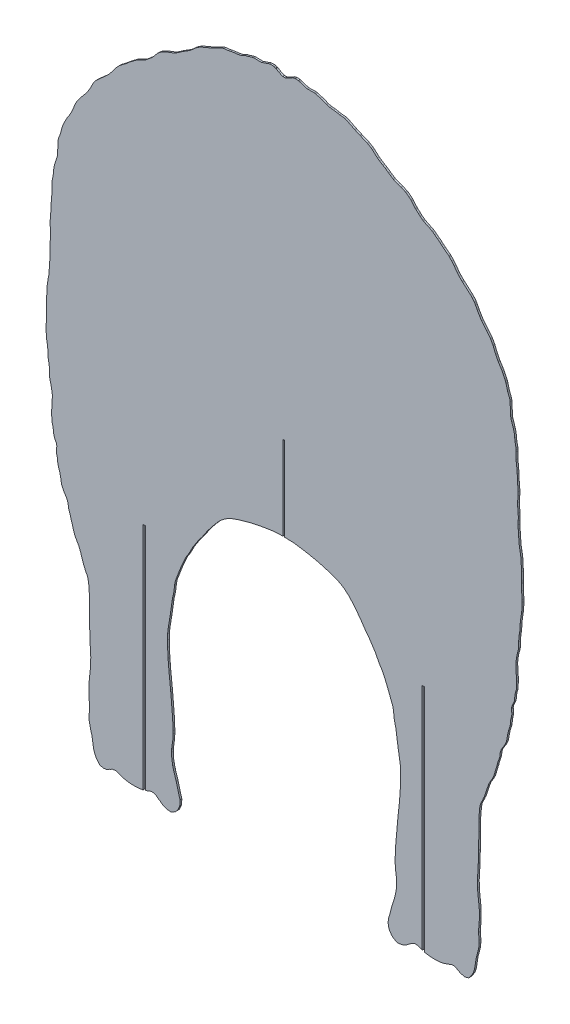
SolidWorks part; units mm, degrees
ref_plane "Спереди" through (0, 0, 0) normal (0, 0, 1) x (1, 0, 0)
ref_plane "Сверху" through (0, 0, 0) normal (0, 1, 0) x (1, 0, 0)
ref_plane "Справа" through (0, 0, 0) normal (1, 0, 0) x (0, 0, -1)
sketch "Model" plane through (0, 0, 0) normal (0, 0, 1) x (1, 0, 0)
  line L0 (-5202.6954, 1099.0275) -> (-5202.6613, 1090.2528)
  line L1 (-5202.6613, 1090.2528) -> (-5202.722, 1088.5068)
  line L2 (-5202.722, 1088.5068) -> (-5202.7725, 1087.6386)
  line L3 (-5202.7725, 1087.6386) -> (-5202.8295, 1086.497)
  line L4 (-5202.8295, 1086.497) -> (-5202.8038, 1080.4098)
  line L5 (-5202.8038, 1080.4098) -> (-5203.304, 1071.0133)
  line L6 (-5203.304, 1071.0133) -> (-5203.3499, 1068.7169)
  line L7 (-5203.3499, 1068.7169) -> (-5203.1594, 1065.0392)
  line L8 (-5203.1594, 1065.0392) -> (-5202.8968, 1060.7317)
  line L9 (-5202.8968, 1060.7317) -> (-5202.8394, 1059.8406)
  line L10 (-5202.8394, 1059.8406) -> (-5202.7721, 1059.4981)
  line L11 (-5202.7721, 1059.4981) -> (-5202.7048, 1059.1557)
  line L12 (-5202.7048, 1059.1557) -> (-5202.5778, 1058.2051)
  line L13 (-5202.5778, 1058.2051) -> (-5201.8625, 1054.0213)
  line L14 (-5201.8625, 1054.0213) -> (-5201.2064, 1048.4236)
  line L15 (-5201.2064, 1048.4236) -> (-5200.9608, 1043.9221)
  line L16 (-5200.9608, 1043.9221) -> (-5200.9158, 1041.1125)
  line L17 (-5200.9158, 1041.1125) -> (-5200.7299, 1040.1642)
  line L18 (-5200.7299, 1040.1642) -> (-5199.9985, 1036.1432)
  line L19 (-5199.9985, 1036.1432) -> (-5199.3775, 1030.2484)
  line L20 (-5199.3775, 1030.2484) -> (-5199.3633, 1030.0172)
  line L21 (-5199.3633, 1030.0172) -> (-5199.349, 1029.7859)
  line L22 (-5199.349, 1029.7859) -> (-5199.3491, 1029.0652)
  line L23 (-5199.3491, 1029.0652) -> (-5199.3344, 1025.183)
  line L24 (-5199.3344, 1025.183) -> (-5199.2947, 1023.4181)
  line L25 (-5199.2947, 1023.4181) -> (-5199.0479, 1021.8089)
  line L26 (-5199.0479, 1021.8089) -> (-5197.7156, 1016.6927)
  line L27 (-5197.7156, 1016.6927) -> (-5197.0541, 1013.0945)
  line L28 (-5197.0541, 1013.0945) -> (-5196.4353, 1008.7228)
  line L29 (-5196.4353, 1008.7228) -> (-5196.4522, 1005.7185)
  line L30 (-5196.4522, 1005.7185) -> (-5196.8237, 996.7969)
  line L31 (-5196.8237, 996.7969) -> (-5197.1856, 993.2269)
  line L32 (-5197.1856, 993.2269) -> (-5197.1784, 990.8832)
  line L33 (-5197.1784, 990.8832) -> (-5196.8452, 982.4718)
  line L34 (-5196.8452, 982.4718) -> (-5196.8103, 982.3772)
  line L35 (-5196.8103, 982.3772) -> (-5196.7753, 982.2826)
  line L36 (-5196.7753, 982.2826) -> (-5196.119, 979.9115)
  line L37 (-5196.119, 979.9115) -> (-5195.7389, 978.5799)
  line L38 (-5195.7389, 978.5799) -> (-5195.3097, 975.8839)
  line L39 (-5195.3097, 975.8839) -> (-5194.6318, 970.3298)
  line L40 (-5194.6318, 970.3298) -> (-5193.9113, 968.4614)
  line L41 (-5193.9113, 968.4614) -> (-5191.9519, 964.4352)
  line L42 (-5191.9519, 964.4352) -> (-5191.7373, 963.2824)
  line L43 (-5191.7373, 963.2824) -> (-5191.3429, 962.0163)
  line L44 (-5191.3429, 962.0163) -> (-5191.7068, 959.2917)
  line L45 (-5191.7068, 959.2917) -> (-5191.9226, 955.297)
  line L46 (-5191.9226, 955.297) -> (-5191.8522, 954.9043)
  line L47 (-5191.8522, 954.9043) -> (-5191.7817, 954.5116)
  line L48 (-5191.7817, 954.5116) -> (-5190.6999, 950.7785)
  line L49 (-5190.6999, 950.7785) -> (-5190.4943, 948.1776)
  line L50 (-5190.4943, 948.1776) -> (-5190.3791, 946.3684)
  line L51 (-5190.3791, 946.3684) -> (-5190.189, 945.3608)
  line L52 (-5190.189, 945.3608) -> (-5190.1329, 944.9966)
  line L53 (-5190.1329, 944.9966) -> (-5190.0769, 944.6323)
  line L54 (-5190.0769, 944.6323) -> (-5189.5729, 942.8308)
  line L55 (-5189.5729, 942.8308) -> (-5188.2397, 938.8125)
  line L56 (-5188.2397, 938.8125) -> (-5187.4042, 935.0848)
  line L57 (-5187.4042, 935.0848) -> (-5186.3434, 928.91)
  line L58 (-5186.3434, 928.91) -> (-5185.9612, 927.2029)
  line L59 (-5185.9612, 927.2029) -> (-5184.4657, 923.8747)
  line L60 (-5184.4657, 923.8747) -> (-5184.075, 922.8846)
  line L61 (-5184.075, 922.8846) -> (-5180.9575, 917.9985)
  line L62 (-5180.9575, 917.9985) -> (-5180.7146, 917.6124)
  line L63 (-5180.7146, 917.6124) -> (-5180.4718, 917.2262)
  line L64 (-5180.4718, 917.2262) -> (-5180.4459, 917.1883)
  line L65 (-5180.4459, 917.1883) -> (-5180.4202, 917.1505)
  line L66 (-5180.4202, 917.1505) -> (-5180.4155, 917.1354)
  line L67 (-5180.4155, 917.1354) -> (-5180.4063, 917.1123)
  line L68 (-5180.4063, 917.1123) -> (-5180.397, 917.0892)
  line L69 (-5180.397, 917.0892) -> (-5178.7982, 912.5182)
  line L70 (-5178.7982, 912.5182) -> (-5178.5048, 908.7762)
  line L71 (-5178.5048, 908.7762) -> (-5177.4256, 905.5194)
  line L72 (-5177.4256, 905.5194) -> (-5176.5963, 903.3575)
  line L73 (-5176.5963, 903.3575) -> (-5175.7757, 900.3268)
  line L74 (-5175.7757, 900.3268) -> (-5175.3259, 898.3794)
  line L75 (-5175.3259, 898.3794) -> (-5174.6636, 896.4902)
  line L76 (-5174.6636, 896.4902) -> (-5173.0345, 890.7728)
  line L77 (-5173.0345, 890.7728) -> (-5171.51, 886.143)
  line L78 (-5171.51, 886.143) -> (-5169.4597, 882.2175)
  line L79 (-5169.4597, 882.2175) -> (-5167.7263, 879.3978)
  line L80 (-5167.7263, 879.3978) -> (-5167.4474, 878.9154)
  line L81 (-5167.4474, 878.9154) -> (-5167.1686, 878.4328)
  line L82 (-5167.1686, 878.4328) -> (-5166.0937, 875.8771)
  line L83 (-5166.0937, 875.8771) -> (-5165.4074, 874.0993)
  line L84 (-5165.4074, 874.0993) -> (-5164.9625, 872.8122)
  line L85 (-5164.9625, 872.8122) -> (-5162.8269, 866.4299)
  line L86 (-5162.8269, 866.4299) -> (-5161.3383, 861.5808)
  line L87 (-5161.3383, 861.5808) -> (-5160.3752, 859.9468)
  line L88 (-5160.3752, 859.9468) -> (-5159.6819, 858.0322)
  line L89 (-5159.6819, 858.0322) -> (-5157.4411, 853.7716)
  line L90 (-5157.4411, 853.7716) -> (-5156.864, 851.5293)
  line L91 (-5156.864, 851.5293) -> (-5156.0519, 847.5389)
  line L92 (-5156.0519, 847.5389) -> (-5155.5784, 840.7879)
  line L93 (-5155.5784, 840.7879) -> (-5155.2749, 837.9112)
  line L94 (-5155.2749, 837.9112) -> (-5155.2221, 837.131)
  line L95 (-5155.2221, 837.131) -> (-5155.3495, 834.1116)
  line L96 (-5155.3495, 834.1116) -> (-5155.3406, 824.707)
  line L97 (-5155.3406, 824.707) -> (-5154.9852, 808.5478)
  line L98 (-5154.9852, 808.5478) -> (-5154.9796, 808.436)
  line L99 (-5154.9796, 808.436) -> (-5154.9777, 808.4044)
  line L100 (-5154.9777, 808.4044) -> (-5154.9758, 808.3728)
  line L101 (-5154.9758, 808.3728) -> (-5154.9719, 808.2165)
  line L102 (-5154.9719, 808.2165) -> (-5154.6212, 793.8742)
  line L103 (-5154.6212, 793.8742) -> (-5153.9423, 781.7596)
  line L104 (-5153.9423, 781.7596) -> (-5153.7074, 777.5233)
  line L105 (-5153.7074, 777.5233) -> (-5153.8593, 770.6618)
  line L106 (-5153.8593, 770.6618) -> (-5153.8638, 769.0992)
  line L107 (-5153.8638, 769.0992) -> (-5154.1451, 766.2424)
  line L108 (-5154.1451, 766.2424) -> (-5155.78, 750.9589)
  line L109 (-5155.78, 750.9589) -> (-5155.8274, 748.5695)
  line L110 (-5155.8274, 748.5695) -> (-5155.813, 742.1856)
  line L111 (-5155.813, 742.1856) -> (-5155.6458, 737.217)
  line L112 (-5155.6458, 737.217) -> (-5155.3478, 733.8855)
  line L113 (-5155.3478, 733.8855) -> (-5155.2457, 732.8574)
  line L114 (-5155.2457, 732.8574) -> (-5155.0552, 731.6394)
  line L115 (-5155.0552, 731.6394) -> (-5155.1755, 727.7783)
  line L116 (-5155.1755, 727.7783) -> (-5155.0831, 726.7011)
  line L117 (-5155.0831, 726.7011) -> (-5155.4994, 721.844)
  line L118 (-5155.4994, 721.844) -> (-5155.4168, 717.852)
  line L119 (-5155.4168, 717.852) -> (-5155.3995, 715.2605)
  line L120 (-5155.3995, 715.2605) -> (-5153.2953, 705.7724)
  line L121 (-5153.2953, 705.7724) -> (-5153.1444, 705.2882)
  line L122 (-5153.1444, 705.2882) -> (-5152.9936, 704.8039)
  line L123 (-5152.9936, 704.8039) -> (-5152.4826, 703.406)
  line L124 (-5152.4826, 703.406) -> (-5150.5491, 690.9375)
  line L125 (-5150.5491, 690.9375) -> (-5149.4514, 687.4006)
  line L126 (-5149.4514, 687.4006) -> (-5147.4421, 683.3005)
  line L127 (-5147.4421, 683.3005) -> (-5147.3192, 683.1079)
  line L128 (-5147.3192, 683.1079) -> (-5147.1438, 682.9483)
  line L129 (-5147.1438, 682.9483) -> (-5146.9684, 682.7888)
  line L130 (-5146.9684, 682.7888) -> (-5144.0571, 679.0772)
  line L131 (-5144.0571, 679.0772) -> (-5143.7053, 678.8127)
  line L132 (-5143.7053, 678.8127) -> (-5143.3536, 678.5483)
  line L133 (-5143.3536, 678.5483) -> (-5142.1622, 678.5129)
  line L134 (-5142.1622, 678.5129) -> (-5140.9709, 678.4774)
  line L135 (-5140.9709, 678.4774) -> (-5140.0018, 678.1411)
  line L136 (-5140.0018, 678.1411) -> (-5139.0327, 677.8049)
  line L137 (-5139.0327, 677.8049) -> (-5137.4784, 678.3115)
  line L138 (-5137.4784, 678.3115) -> (-5136.8331, 678.3803)
  line L139 (-5136.8331, 678.3803) -> (-5136.1879, 678.4493)
  line L140 (-5136.1879, 678.4493) -> (-5133.1083, 680.1442)
  line L141 (-5133.1083, 680.1442) -> (-5131.9337, 680.5439)
  line L142 (-5131.9337, 680.5439) -> (-5130.1296, 681.7739)
  line L143 (-5130.1296, 681.7739) -> (-5127.9844, 682.1023)
  line L144 (-5127.9844, 682.1023) -> (-5127.6564, 682.2944)
  line L145 (-5127.6564, 682.2944) -> (-5127.3284, 682.4867)
  line L146 (-5127.3284, 682.4867) -> (-5126.6455, 682.4519)
  line L147 (-5126.6455, 682.4519) -> (-5125.9627, 682.4172)
  line L148 (-5125.9627, 682.4172) -> (-5125.1232, 682.3525)
  line L149 (-5125.1232, 682.3525) -> (-5122.8449, 681.4699)
  line L150 (-5122.8449, 681.4699) -> (-5116.2452, 679.1328)
  line L151 (-5116.2452, 679.1328) -> (-5113.3743, 678.6247)
  line L152 (-5113.3743, 678.6247) -> (-5109.0183, 678.0993)
  line L153 (-5109.0183, 678.0993) -> (-5104.8963, 678.0749)
  line L154 (-5104.8963, 678.0749) -> (-5101.2264, 678.2614)
  line L155 (-5101.2264, 678.2614) -> (-5096.9241, 678.7651)
  line L156 (-5096.9241, 678.7651) -> (-5095.729, 678.9841)
  line L157 (-5095.729, 678.9841) -> (-5095.7111, 678.9887)
  line L158 (-5095.7111, 678.9887) -> (-5095.7111, 934.2953)
  line L159 (-5095.7111, 934.2953) -> (-5095.4611, 934.2953)
  line L160 (-5095.4611, 934.2953) -> (-5093.4611, 934.2953)
  line L161 (-5093.4611, 934.2953) -> (-5093.2111, 934.2953)
  line L162 (-5093.2111, 934.2953) -> (-5093.2111, 679.5849)
  line L163 (-5093.2111, 679.5849) -> (-5093.1267, 679.6047)
  line L164 (-5093.1267, 679.6047) -> (-5091.9054, 680.1276)
  line L165 (-5091.9054, 680.1276) -> (-5088.0388, 681.7271)
  line L166 (-5088.0388, 681.7271) -> (-5086.8471, 682.013)
  line L167 (-5086.8471, 682.013) -> (-5084.105, 682.1573)
  line L168 (-5084.105, 682.1573) -> (-5083.5109, 682.0266)
  line L169 (-5083.5109, 682.0266) -> (-5082.9168, 681.8957)
  line L170 (-5082.9168, 681.8957) -> (-5080.9629, 680.8281)
  line L171 (-5080.9629, 680.8281) -> (-5078.8604, 678.9016)
  line L172 (-5078.8604, 678.9016) -> (-5078.8162, 678.9692)
  line L173 (-5078.8162, 678.9692) -> (-5078.772, 679.0367)
  line L174 (-5078.772, 679.0367) -> (-5076.4213, 677.5468)
  line L175 (-5076.4213, 677.5468) -> (-5075.4188, 676.5524)
  line L176 (-5075.4188, 676.5524) -> (-5074.6463, 676.0161)
  line L177 (-5074.6463, 676.0161) -> (-5072.4133, 675.0185)
  line L178 (-5072.4133, 675.0185) -> (-5071.9331, 674.7204)
  line L179 (-5071.9331, 674.7204) -> (-5071.4528, 674.4224)
  line L180 (-5071.4528, 674.4224) -> (-5068.3278, 673.654)
  line L181 (-5068.3278, 673.654) -> (-5067.5283, 673.3813)
  line L182 (-5067.5283, 673.3813) -> (-5064.4964, 673.304)
  line L183 (-5064.4964, 673.304) -> (-5063.8679, 673.5256)
  line L184 (-5063.8679, 673.5256) -> (-5063.2395, 673.747)
  line L185 (-5063.2395, 673.747) -> (-5061.3798, 675.1721)
  line L186 (-5061.3798, 675.1721) -> (-5059.8366, 675.8855)
  line L187 (-5059.8366, 675.8855) -> (-5057.3812, 678.5643)
  line L188 (-5057.3812, 678.5643) -> (-5056.7214, 679.6286)
  line L189 (-5056.7214, 679.6286) -> (-5056.5191, 680.4282)
  line L190 (-5056.5191, 680.4282) -> (-5055.6295, 682.297)
  line L191 (-5055.6295, 682.297) -> (-5054.9537, 683.715)
  line L192 (-5054.9537, 683.715) -> (-5054.6406, 689.6416)
  line L193 (-5054.6406, 689.6416) -> (-5054.6367, 689.9714)
  line L194 (-5054.6367, 689.9714) -> (-5054.7415, 690.4467)
  line L195 (-5054.7415, 690.4467) -> (-5056.4092, 696.1143)
  line L196 (-5056.4092, 696.1143) -> (-5058.7814, 705.5661)
  line L197 (-5058.7814, 705.5661) -> (-5058.8091, 705.643)
  line L198 (-5058.8091, 705.643) -> (-5058.8368, 705.7198)
  line L199 (-5058.8368, 705.7198) -> (-5061.3606, 713.4025)
  line L200 (-5061.3606, 713.4025) -> (-5061.9202, 715.7479)
  line L201 (-5061.9202, 715.7479) -> (-5062.7064, 718.5022)
  line L202 (-5062.7064, 718.5022) -> (-5063.084, 721.0147)
  line L203 (-5063.084, 721.0147) -> (-5063.7592, 724.2583)
  line L204 (-5063.7592, 724.2583) -> (-5063.9633, 730.9787)
  line L205 (-5063.9633, 730.9787) -> (-5064.0633, 733.3053)
  line L206 (-5064.0633, 733.3053) -> (-5063.8925, 734.5938)
  line L207 (-5063.8925, 734.5938) -> (-5062.5761, 744.039)
  line L208 (-5062.5761, 744.039) -> (-5062.4101, 749.3352)
  line L209 (-5062.4101, 749.3352) -> (-5062.4069, 752.3161)
  line L210 (-5062.4069, 752.3161) -> (-5062.6228, 759.9057)
  line L211 (-5062.6228, 759.9057) -> (-5063.0546, 766.9058)
  line L212 (-5063.0546, 766.9058) -> (-5064.7495, 786.9555)
  line L213 (-5064.7495, 786.9555) -> (-5064.8992, 788.524)
  line L214 (-5064.8992, 788.524) -> (-5065.0633, 790.3146)
  line L215 (-5065.0633, 790.3146) -> (-5066.9088, 807.7543)
  line L216 (-5066.9088, 807.7543) -> (-5067.4115, 813.884)
  line L217 (-5067.4115, 813.884) -> (-5067.8513, 818.4278)
  line L218 (-5067.8513, 818.4278) -> (-5067.9194, 819.8093)
  line L219 (-5067.9194, 819.8093) -> (-5068.387, 829.4878)
  line L220 (-5068.387, 829.4878) -> (-5068.3911, 836.7295)
  line L221 (-5068.3911, 836.7295) -> (-5068.4461, 842.4897)
  line L222 (-5068.4461, 842.4897) -> (-5067.7922, 848.131)
  line L223 (-5067.7922, 848.131) -> (-5067.7898, 848.1542)
  line L224 (-5067.7898, 848.1542) -> (-5067.7874, 848.1775)
  line L225 (-5067.7874, 848.1775) -> (-5067.7687, 848.2898)
  line L226 (-5067.7687, 848.2898) -> (-5065.7103, 860.8678)
  line L227 (-5065.7103, 860.8678) -> (-5064.3615, 869.9947)
  line L228 (-5064.3615, 869.9947) -> (-5063.4254, 876.9441)
  line L229 (-5063.4254, 876.9441) -> (-5063.0011, 879.5567)
  line L230 (-5063.0011, 879.5567) -> (-5062.3021, 882.4)
  line L231 (-5062.3021, 882.4) -> (-5061.4442, 886.4664)
  line L232 (-5061.4442, 886.4664) -> (-5060.6844, 893.0699)
  line L233 (-5060.6844, 893.0699) -> (-5060.5956, 893.9961)
  line L234 (-5060.5956, 893.9961) -> (-5060.5634, 894.1227)
  line L235 (-5060.5634, 894.1227) -> (-5060.5313, 894.2491)
  line L236 (-5060.5313, 894.2491) -> (-5059.7145, 898.1553)
  line L237 (-5059.7145, 898.1553) -> (-5059.0864, 899.9397)
  line L238 (-5059.0864, 899.9397) -> (-5058.962, 900.2528)
  line L239 (-5058.962, 900.2528) -> (-5058.8376, 900.5658)
  line L240 (-5058.8376, 900.5658) -> (-5058.2587, 901.969)
  line L241 (-5058.2587, 901.969) -> (-5054.9058, 910.9272)
  line L242 (-5054.9058, 910.9272) -> (-5051.497, 919.1446)
  line L243 (-5051.497, 919.1446) -> (-5050.2281, 921.8449)
  line L244 (-5050.2281, 921.8449) -> (-5048.167, 926.3814)
  line L245 (-5048.167, 926.3814) -> (-5045.7388, 930.0707)
  line L246 (-5045.7388, 930.0707) -> (-5045.1654, 931.0162)
  line L247 (-5045.1654, 931.0162) -> (-5043.5745, 933.9931)
  line L248 (-5043.5745, 933.9931) -> (-5040.2687, 940.3531)
  line L249 (-5040.2687, 940.3531) -> (-5035.7192, 947.2965)
  line L250 (-5035.7192, 947.2965) -> (-5033.5709, 950.5819)
  line L251 (-5033.5709, 950.5819) -> (-5031.7586, 952.8146)
  line L252 (-5031.7586, 952.8146) -> (-5030.5583, 954.3714)
  line L253 (-5030.5583, 954.3714) -> (-5027.3518, 958.8523)
  line L254 (-5027.3518, 958.8523) -> (-5027.21, 959.0665)
  line L255 (-5027.21, 959.0665) -> (-5027.0682, 959.2809)
  line L256 (-5027.0682, 959.2809) -> (-5026.9401, 959.4217)
  line L257 (-5026.9401, 959.4217) -> (-5025.1249, 962.3045)
  line L258 (-5025.1249, 962.3045) -> (-5023.9854, 964.0729)
  line L259 (-5023.9854, 964.0729) -> (-5021.7281, 966.8559)
  line L260 (-5021.7281, 966.8559) -> (-5020.1921, 969.0414)
  line L261 (-5020.1921, 969.0414) -> (-5016.4483, 973.5843)
  line L262 (-5016.4483, 973.5843) -> (-5015.2499, 975.0765)
  line L263 (-5015.2499, 975.0765) -> (-5013.1365, 977.3758)
  line L264 (-5013.1365, 977.3758) -> (-5011.3665, 979.3941)
  line L265 (-5011.3665, 979.3941) -> (-5010.9033, 979.9366)
  line L266 (-5010.9033, 979.9366) -> (-5009.9137, 980.8534)
  line L267 (-5009.9137, 980.8534) -> (-5005.4434, 984.4811)
  line L268 (-5005.4434, 984.4811) -> (-5004.6682, 984.9928)
  line L269 (-5004.6682, 984.9928) -> (-5001.7788, 986.8583)
  line L270 (-5001.7788, 986.8583) -> (-4998.0692, 988.6616)
  line L271 (-4998.0692, 988.6616) -> (-4997.4453, 988.9515)
  line L272 (-4997.4453, 988.9515) -> (-4996.8214, 989.2413)
  line L273 (-4996.8214, 989.2413) -> (-4989.069, 991.9322)
  line L274 (-4989.069, 991.9322) -> (-4988.091, 992.2569)
  line L275 (-4988.091, 992.2569) -> (-4987.256, 992.4718)
  line L276 (-4987.256, 992.4718) -> (-4986.421, 992.6867)
  line L277 (-4986.421, 992.6867) -> (-4977.1057, 995.316)
  line L278 (-4977.1057, 995.316) -> (-4969.195, 997.0088)
  line L279 (-4969.195, 997.0088) -> (-4968.6661, 997.1231)
  line L280 (-4968.6661, 997.1231) -> (-4968.1375, 997.2374)
  line L281 (-4968.1375, 997.2374) -> (-4963.2979, 998.155)
  line L282 (-4963.2979, 998.155) -> (-4961.0531, 998.5993)
  line L283 (-4961.0531, 998.5993) -> (-4960.8129, 998.6296)
  line L284 (-4960.8129, 998.6296) -> (-4951.7425, 999.9855)
  line L285 (-4951.7425, 999.9855) -> (-4949.61, 1000.1376)
  line L286 (-4949.61, 1000.1376) -> (-4944.8473, 1000.5338)
  line L287 (-4944.8473, 1000.5338) -> (-4940.4611, 1000.5564)
  line L288 (-4940.4611, 1000.5564) -> (-4940.4611, 1093.6418)
  line L289 (-4940.4611, 1093.6418) -> (-4938.4611, 1093.6418)
  line L290 (-4938.4611, 1093.6418) -> (-4938.4611, 1000.5414)
  line L295 (-4938.4611, 1000.5414) -> (-4929.0118, 1000.2191)
  line L296 (-4929.0118, 1000.2191) -> (-4928.0068, 1000.1334)
  line L297 (-4928.0068, 1000.1334) -> (-4927.0017, 1000.0476)
  line L298 (-4927.0017, 1000.0476) -> (-4917.3661, 998.6314)
  line L299 (-4917.3661, 998.6314) -> (-4917.0518, 998.5912)
  line L300 (-4917.0518, 998.5912) -> (-4914.8036, 998.1426)
  line L301 (-4914.8036, 998.1426) -> (-4909.9403, 997.2215)
  line L302 (-4909.9403, 997.2215) -> (-4908.5605, 996.9237)
  line L303 (-4908.5605, 996.9237) -> (-4901.0555, 995.3148)
  line L304 (-4901.0555, 995.3148) -> (-4891.7802, 992.7018)
  line L305 (-4891.7802, 992.7018) -> (-4890.1712, 992.2857)
  line L306 (-4890.1712, 992.2857) -> (-4889.2486, 991.975)
  line L307 (-4889.2486, 991.975) -> (-4881.4832, 989.32)
  line L308 (-4881.4832, 989.32) -> (-4877.3622, 987.2958)
  line L309 (-4877.3622, 987.2958) -> (-4876.3005, 986.8226)
  line L310 (-4876.3005, 986.8226) -> (-4872.6542, 984.4324)
  line L311 (-4872.6542, 984.4324) -> (-4872.451, 984.296)
  line L312 (-4872.451, 984.296) -> (-4872.2477, 984.1598)
  line L313 (-4872.2477, 984.1598) -> (-4872.0983, 984.0218)
  line L314 (-4872.0983, 984.0218) -> (-4871.949, 983.884)
  line L315 (-4871.949, 983.884) -> (-4867.0999, 979.802)
  line L316 (-4867.0999, 979.802) -> (-4866.8335, 979.4981)
  line L317 (-4866.8335, 979.4981) -> (-4866.5671, 979.1944)
  line L318 (-4866.5671, 979.1944) -> (-4864.8482, 977.19)
  line L319 (-4864.8482, 977.19) -> (-4862.8944, 975.0598)
  line L320 (-4862.8944, 975.0598) -> (-4861.4952, 973.3164)
  line L321 (-4861.4952, 973.3164) -> (-4857.9316, 968.9934)
  line L322 (-4857.9316, 968.9934) -> (-4856.4099, 966.8185)
  line L323 (-4856.4099, 966.8185) -> (-4854.1273, 964.0057)
  line L324 (-4854.1273, 964.0057) -> (-4852.916, 962.11)
  line L325 (-4852.916, 962.11) -> (-4851.2769, 959.4903)
  line L326 (-4851.2769, 959.4903) -> (-4851.1787, 959.3839)
  line L327 (-4851.1787, 959.3839) -> (-4850.9587, 959.0514)
  line L328 (-4850.9587, 959.0514) -> (-4847.6622, 954.458)
  line L329 (-4847.6622, 954.458) -> (-4846.3833, 952.7939)
  line L330 (-4846.3833, 952.7939) -> (-4844.5884, 950.5804)
  line L331 (-4844.5884, 950.5804) -> (-4842.3912, 947.2152)
  line L332 (-4842.3912, 947.2152) -> (-4837.9391, 940.4322)
  line L333 (-4837.9391, 940.4322) -> (-4834.6139, 934.0521)
  line L334 (-4834.6139, 934.0521) -> (-4832.9069, 930.8635)
  line L335 (-4832.9069, 930.8635) -> (-4832.2498, 929.7693)
  line L336 (-4832.2498, 929.7693) -> (-4829.9681, 926.3189)
  line L337 (-4829.9681, 926.3189) -> (-4827.921, 921.8161)
  line L338 (-4827.921, 921.8161) -> (-4826.7684, 919.3771)
  line L339 (-4826.7684, 919.3771) -> (-4823.3662, 911.2057)
  line L340 (-4823.3662, 911.2057) -> (-4819.7588, 901.6056)
  line L341 (-4819.7588, 901.6056) -> (-4819.2579, 900.3867)
  line L342 (-4819.2579, 900.3867) -> (-4819.1575, 900.1383)
  line L343 (-4819.1575, 900.1383) -> (-4819.0572, 899.89)
  line L344 (-4819.0572, 899.89) -> (-4818.413, 898.0543)
  line L345 (-4818.413, 898.0543) -> (-4817.6482, 894.3298)
  line L346 (-4817.6482, 894.3298) -> (-4817.5605, 893.9819)
  line L347 (-4817.5605, 893.9819) -> (-4817.4094, 892.3543)
  line L348 (-4817.4094, 892.3543) -> (-4816.9723, 888.3692)
  line L349 (-4816.9723, 888.3692) -> (-4816.7769, 886.7096)
  line L350 (-4816.7769, 886.7096) -> (-4815.9309, 882.6775)
  line L351 (-4815.9309, 882.6775) -> (-4815.1305, 879.332)
  line L352 (-4815.1305, 879.332) -> (-4814.7364, 876.9293)
  line L353 (-4814.7364, 876.9293) -> (-4813.8366, 870.2795)
  line L354 (-4813.8366, 870.2795) -> (-4812.1928, 859.1339)
  line L355 (-4812.1928, 859.1339) -> (-4810.482, 848.7718)
  line L356 (-4810.482, 848.7718) -> (-4810.3412, 847.935)
  line L357 (-4810.3412, 847.935) -> (-4810.302, 847.5554)
  line L358 (-4810.302, 847.5554) -> (-4809.727, 842.6872)
  line L359 (-4809.727, 842.6872) -> (-4809.7962, 836.8834)
  line L360 (-4809.7962, 836.8834) -> (-4809.786, 828.9548)
  line L361 (-4809.786, 828.9548) -> (-4810.1534, 821.3894)
  line L362 (-4810.1534, 821.3894) -> (-4810.2472, 819.2882)
  line L363 (-4810.2472, 819.2882) -> (-4810.8243, 812.8227)
  line L364 (-4810.8243, 812.8227) -> (-4811.0833, 809.1893)
  line L365 (-4811.0833, 809.1893) -> (-4812.2191, 798.5748)
  line L366 (-4812.2191, 798.5748) -> (-4813.008, 791.162)
  line L367 (-4813.008, 791.162) -> (-4815.0799, 767.2858)
  line L368 (-4815.0799, 767.2858) -> (-4815.5393, 759.8237)
  line L369 (-4815.5393, 759.8237) -> (-4815.7617, 752.4594)
  line L370 (-4815.7617, 752.4594) -> (-4815.7554, 749.7688)
  line L371 (-4815.7554, 749.7688) -> (-4815.5853, 744.1539)
  line L372 (-4815.5853, 744.1539) -> (-4814.1558, 733.6004)
  line L373 (-4814.1558, 733.6004) -> (-4814.1313, 733.4191)
  line L374 (-4814.1313, 733.4191) -> (-4814.1441, 733.0771)
  line L375 (-4814.1441, 733.0771) -> (-4814.3704, 724.6057)
  line L376 (-4814.3704, 724.6057) -> (-4815.0423, 721.2351)
  line L377 (-4815.0423, 721.2351) -> (-4815.2257, 719.6508)
  line L378 (-4815.2257, 719.6508) -> (-4816.0154, 717.03)
  line L379 (-4816.0154, 717.03) -> (-4816.2175, 715.6777)
  line L380 (-4816.2175, 715.6777) -> (-4816.7387, 713.6272)
  line L381 (-4816.7387, 713.6272) -> (-4818.9255, 706.9362)
  line L382 (-4818.9255, 706.9362) -> (-4819.6244, 704.9809)
  line L383 (-4819.6244, 704.9809) -> (-4821.9199, 695.6003)
  line L384 (-4821.9199, 695.6003) -> (-4822.955, 692.3139)
  line L385 (-4822.955, 692.3139) -> (-4823.3551, 690.285)
  line L386 (-4823.3551, 690.285) -> (-4823.5292, 688.1691)
  line L387 (-4823.5292, 688.1691) -> (-4823.5377, 686.6945)
  line L388 (-4823.5377, 686.6945) -> (-4823.1473, 683.6755)
  line L389 (-4823.1473, 683.6755) -> (-4822.7586, 682.5433)
  line L390 (-4822.7586, 682.5433) -> (-4822.5069, 681.4824)
  line L391 (-4822.5069, 681.4824) -> (-4820.8359, 678.9912)
  line L392 (-4820.8359, 678.9912) -> (-4820.226, 677.9311)
  line L393 (-4820.226, 677.9311) -> (-4818.1917, 675.7983)
  line L394 (-4818.1917, 675.7983) -> (-4816.6343, 675.0896)
  line L395 (-4816.6343, 675.0896) -> (-4815.0059, 673.7424)
  line L396 (-4815.0059, 673.7424) -> (-4813.781, 673.3898)
  line L397 (-4813.781, 673.3898) -> (-4811.2436, 673.344)
  line L398 (-4811.2436, 673.344) -> (-4810.2442, 673.6357)
  line L399 (-4810.2442, 673.6357) -> (-4806.8604, 674.2902)
  line L400 (-4806.8604, 674.2902) -> (-4805.0705, 675.3774)
  line L401 (-4805.0705, 675.3774) -> (-4802.5789, 676.6401)
  line L402 (-4802.5789, 676.6401) -> (-4802.143, 677.0119)
  line L403 (-4802.143, 677.0119) -> (-4801.8483, 677.3271)
  line L404 (-4801.8483, 677.3271) -> (-4799.2142, 679.2065)
  line L405 (-4799.2142, 679.2065) -> (-4798.1901, 680.0669)
  line L406 (-4798.1901, 680.0669) -> (-4797.6116, 680.4707)
  line L407 (-4797.6116, 680.4707) -> (-4797.0331, 680.8743)
  line L408 (-4797.0331, 680.8743) -> (-4794.7575, 681.965)
  line L409 (-4794.7575, 681.965) -> (-4794.2679, 682.0551)
  line L410 (-4794.2679, 682.0551) -> (-4793.7783, 682.1453)
  line L411 (-4793.7783, 682.1453) -> (-4790.887, 681.9056)
  line L412 (-4790.887, 681.9056) -> (-4790.4952, 681.8159)
  line L413 (-4790.4952, 681.8159) -> (-4790.1034, 681.7263)
  line L414 (-4790.1034, 681.7263) -> (-4786.1959, 680.0918)
  line L415 (-4786.1959, 680.0918) -> (-4785.8285, 679.9748)
  line L416 (-4785.8285, 679.9748) -> (-4785.7111, 679.9375)
  line L417 (-4785.7111, 679.9375) -> (-4785.7111, 934.2953)
  line L418 (-4785.7111, 934.2953) -> (-4785.4611, 934.2953)
  line L419 (-4785.4611, 934.2953) -> (-4783.4611, 934.2953)
  line L420 (-4783.4611, 934.2953) -> (-4783.2111, 934.2953)
  line L421 (-4783.2111, 934.2953) -> (-4783.2111, 679.1421)
  line L422 (-4783.2111, 679.1421) -> (-4783.1671, 679.1281)
  line L423 (-4783.1671, 679.1281) -> (-4782.8548, 679.0683)
  line L424 (-4782.8548, 679.0683) -> (-4782.7376, 679.069)
  line L425 (-4782.7376, 679.069) -> (-4782.6203, 679.0697)
  line L426 (-4782.6203, 679.0697) -> (-4777.6592, 678.3399)
  line L427 (-4777.6592, 678.3399) -> (-4773.5696, 678.0676)
  line L428 (-4773.5696, 678.0676) -> (-4769.3945, 678.1076)
  line L429 (-4769.3945, 678.1076) -> (-4764.9843, 678.5476)
  line L430 (-4764.9843, 678.5476) -> (-4762.2557, 679.0578)
  line L431 (-4762.2557, 679.0578) -> (-4758.9929, 680.1176)
  line L432 (-4758.9929, 680.1176) -> (-4756.1631, 681.1357)
  line L433 (-4756.1631, 681.1357) -> (-4752.9693, 682.3903)
  line L434 (-4752.9693, 682.3903) -> (-4751.9332, 682.528)
  line L435 (-4751.9332, 682.528) -> (-4750.6917, 682.5009)
  line L436 (-4750.6917, 682.5009) -> (-4750.0297, 682.1201)
  line L437 (-4750.0297, 682.1201) -> (-4748.6306, 681.8828)
  line L438 (-4748.6306, 681.8828) -> (-4746.684, 680.7819)
  line L439 (-4746.684, 680.7819) -> (-4745.9604, 680.5158)
  line L440 (-4745.9604, 680.5158) -> (-4742.7314, 678.724)
  line L441 (-4742.7314, 678.724) -> (-4740.3545, 678.3547)
  line L442 (-4740.3545, 678.3547) -> (-4738.7493, 677.7153)
  line L443 (-4738.7493, 677.7153) -> (-4735.3283, 678.7171)
  line L444 (-4735.3283, 678.7171) -> (-4734.8573, 678.7563)
  line L445 (-4734.8573, 678.7563) -> (-4734.3864, 678.7954)
  line L446 (-4734.3864, 678.7954) -> (-4733.9733, 679.1235)
  line L447 (-4733.9733, 679.1235) -> (-4730.7924, 683.1917)
  line L448 (-4730.7924, 683.1917) -> (-4730.6945, 683.5412)
  line L449 (-4730.6945, 683.5412) -> (-4728.9125, 686.5385)
  line L450 (-4728.9125, 686.5385) -> (-4727.7004, 690.5074)
  line L451 (-4727.7004, 690.5074) -> (-4725.5785, 703.594)
  line L452 (-4725.5785, 703.594) -> (-4725.4233, 704.0153)
  line L453 (-4725.4233, 704.0153) -> (-4725.2681, 704.4366)
  line L454 (-4725.2681, 704.4366) -> (-4723.9169, 709.7834)
  line L455 (-4723.9169, 709.7834) -> (-4723.0822, 713.049)
  line L456 (-4723.0822, 713.049) -> (-4723.037, 713.4035)
  line L457 (-4723.037, 713.4035) -> (-4722.966, 714.0703)
  line L458 (-4722.966, 714.0703) -> (-4722.7033, 717.6585)
  line L459 (-4722.7033, 717.6585) -> (-4722.6384, 720.8841)
  line L460 (-4722.6384, 720.8841) -> (-4723.1289, 727.3759)
  line L461 (-4723.1289, 727.3759) -> (-4722.9994, 728.7846)
  line L462 (-4722.9994, 728.7846) -> (-4723.0092, 732.465)
  line L463 (-4723.0092, 732.465) -> (-4722.9203, 733.1074)
  line L464 (-4722.9203, 733.1074) -> (-4722.7566, 734.6644)
  line L465 (-4722.7566, 734.6644) -> (-4722.4749, 738.0383)
  line L466 (-4722.4749, 738.0383) -> (-4722.3359, 742.0349)
  line L467 (-4722.3359, 742.0349) -> (-4722.3278, 748.3286)
  line L468 (-4722.3278, 748.3286) -> (-4722.3821, 750.785)
  line L469 (-4722.3821, 750.785) -> (-4722.8673, 755.7751)
  line L470 (-4722.8673, 755.7751) -> (-4724.2868, 768.7885)
  line L471 (-4724.2868, 768.7885) -> (-4724.2963, 770.6419)
  line L472 (-4724.2963, 770.6419) -> (-4724.4696, 777.1401)
  line L473 (-4724.4696, 777.1401) -> (-4724.2258, 781.5145)
  line L474 (-4724.2258, 781.5145) -> (-4723.5514, 793.6723)
  line L475 (-4723.5514, 793.6723) -> (-4723.5198, 794.7882)
  line L476 (-4723.5198, 794.7882) -> (-4723.2529, 806.5016)
  line L477 (-4723.2529, 806.5016) -> (-4723.2492, 806.5965)
  line L478 (-4723.2492, 806.5965) -> (-4723.2456, 806.6915)
  line L479 (-4723.2456, 806.6915) -> (-4723.24, 806.7481)
  line L480 (-4723.24, 806.7481) -> (-4723.2344, 806.8049)
  line L481 (-4723.2344, 806.8049) -> (-4723.2093, 807.3633)
  line L482 (-4723.2093, 807.3633) -> (-4722.811, 825.0754)
  line L483 (-4722.811, 825.0754) -> (-4722.8187, 833.9035)
  line L484 (-4722.8187, 833.9035) -> (-4722.9403, 836.8752)
  line L485 (-4722.9403, 836.8752) -> (-4722.8723, 837.6803)
  line L486 (-4722.8723, 837.6803) -> (-4722.2763, 844.5877)
  line L487 (-4722.2763, 844.5877) -> (-4721.9786, 848.748)
  line L488 (-4721.9786, 848.748) -> (-4721.8596, 849.2395)
  line L489 (-4721.8596, 849.2395) -> (-4721.1259, 852.4067)
  line L490 (-4721.1259, 852.4067) -> (-4719.9884, 855.2287)
  line L491 (-4719.9884, 855.2287) -> (-4718.4292, 858.0101)
  line L492 (-4718.4292, 858.0101) -> (-4717.7593, 860.0223)
  line L493 (-4717.7593, 860.0223) -> (-4716.6936, 861.9866)
  line L494 (-4716.6936, 861.9866) -> (-4715.2581, 866.7219)
  line L495 (-4715.2581, 866.7219) -> (-4713.1996, 872.7103)
  line L496 (-4713.1996, 872.7103) -> (-4712.5807, 874.4686)
  line L497 (-4712.5807, 874.4686) -> (-4711.3427, 877.7738)
  line L498 (-4711.3427, 877.7738) -> (-4711.3049, 877.8651)
  line L499 (-4711.3049, 877.8651) -> (-4711.267, 877.9563)
  line L500 (-4711.267, 877.9563) -> (-4711.2214, 878.0345)
  line L501 (-4711.2214, 878.0345) -> (-4711.1759, 878.1127)
  line L502 (-4711.1759, 878.1127) -> (-4708.1428, 883.1634)
  line L503 (-4708.1428, 883.1634) -> (-4706.6845, 885.983)
  line L504 (-4706.6845, 885.983) -> (-4705.2879, 890.3176)
  line L505 (-4705.2879, 890.3176) -> (-4703.2799, 897.1166)
  line L506 (-4703.2799, 897.1166) -> (-4702.7252, 898.7571)
  line L507 (-4702.7252, 898.7571) -> (-4702.2051, 900.9188)
  line L508 (-4702.2051, 900.9188) -> (-4701.5542, 903.3888)
  line L509 (-4701.5542, 903.3888) -> (-4700.7691, 905.4183)
  line L510 (-4700.7691, 905.4183) -> (-4699.6224, 908.9383)
  line L511 (-4699.6224, 908.9383) -> (-4699.3101, 912.7568)
  line L512 (-4699.3101, 912.7568) -> (-4698.2972, 915.9619)
  line L513 (-4698.2972, 915.9619) -> (-4698.1599, 916.3014)
  line L514 (-4698.1599, 916.3014) -> (-4698.0226, 916.6407)
  line L515 (-4698.0226, 916.6407) -> (-4697.4577, 917.5128)
  line L516 (-4697.4577, 917.5128) -> (-4696.1778, 919.6491)
  line L517 (-4696.1778, 919.6491) -> (-4694.218, 922.6712)
  line L518 (-4694.218, 922.6712) -> (-4692.277, 927.0606)
  line L519 (-4692.277, 927.0606) -> (-4691.8341, 928.9808)
  line L520 (-4691.8341, 928.9808) -> (-4690.7719, 935.0184)
  line L521 (-4690.7719, 935.0184) -> (-4689.9043, 938.8235)
  line L522 (-4689.9043, 938.8235) -> (-4688.3107, 943.7525)
  line L523 (-4688.3107, 943.7525) -> (-4688.0664, 944.6705)
  line L524 (-4688.0664, 944.6705) -> (-4688.0203, 944.923)
  line L525 (-4688.0203, 944.923) -> (-4687.9211, 945.447)
  line L526 (-4687.9211, 945.447) -> (-4687.8659, 946.294)
  line L527 (-4687.8659, 946.294) -> (-4687.4362, 950.8751)
  line L528 (-4687.4362, 950.8751) -> (-4687.0392, 952.0624)
  line L529 (-4687.0392, 952.0624) -> (-4686.3438, 955.7312)
  line L530 (-4686.3438, 955.7312) -> (-4686.2863, 957.812)
  line L531 (-4686.2863, 957.812) -> (-4686.7116, 961.716)
  line L532 (-4686.7116, 961.716) -> (-4686.4224, 962.8934)
  line L533 (-4686.4224, 962.8934) -> (-4686.1708, 964.5421)
  line L534 (-4686.1708, 964.5421) -> (-4684.1772, 968.5993)
  line L535 (-4684.1772, 968.5993) -> (-4683.5048, 970.3371)
  line L536 (-4683.5048, 970.3371) -> (-4682.8531, 976.1028)
  line L537 (-4682.8531, 976.1028) -> (-4682.5304, 978.2178)
  line L538 (-4682.5304, 978.2178) -> (-4682.072, 979.8141)
  line L539 (-4682.072, 979.8141) -> (-4681.3311, 982.2506)
  line L540 (-4681.3311, 982.2506) -> (-4681.0439, 989.6561)
  line L541 (-4681.0439, 989.6561) -> (-4680.9132, 990.9825)
  line L542 (-4680.9132, 990.9825) -> (-4680.9627, 993.415)
  line L543 (-4680.9627, 993.415) -> (-4681.3265, 996.5099)
  line L544 (-4681.3265, 996.5099) -> (-4681.7286, 1005.6533)
  line L545 (-4681.7286, 1005.6533) -> (-4681.7591, 1007.9551)
  line L546 (-4681.7591, 1007.9551) -> (-4681.1013, 1013.1407)
  line L547 (-4681.1013, 1013.1407) -> (-4680.4231, 1016.843)
  line L548 (-4680.4231, 1016.843) -> (-4679.0476, 1021.8546)
  line L549 (-4679.0476, 1021.8546) -> (-4678.8826, 1022.9438)
  line L550 (-4678.8826, 1022.9438) -> (-4678.8699, 1024.0168)
  line L551 (-4678.8699, 1024.0168) -> (-4678.7792, 1029.5137)
  line L552 (-4678.7792, 1029.5137) -> (-4678.7774, 1029.6841)
  line L553 (-4678.7774, 1029.6841) -> (-4678.7735, 1029.7434)
  line L554 (-4678.7735, 1029.7434) -> (-4678.1662, 1036.1206)
  line L555 (-4678.1662, 1036.1206) -> (-4677.5728, 1039.68)
  line L556 (-4677.5728, 1039.68) -> (-4677.2586, 1041.3083)
  line L557 (-4677.2586, 1041.3083) -> (-4677.2489, 1043.3573)
  line L558 (-4677.2489, 1043.3573) -> (-4676.964, 1048.2626)
  line L559 (-4676.964, 1048.2626) -> (-4676.2813, 1054.2578)
  line L560 (-4676.2813, 1054.2578) -> (-4675.5877, 1058.2654)
  line L561 (-4675.5877, 1058.2654) -> (-4675.4504, 1059.3078)
  line L562 (-4675.4504, 1059.3078) -> (-4675.3467, 1059.8104)
  line L563 (-4675.3467, 1059.8104) -> (-4675.2841, 1060.6291)
  line L564 (-4675.2841, 1060.6291) -> (-4675.0459, 1064.7119)
  line L565 (-4675.0459, 1064.7119) -> (-4674.8051, 1069.5183)
  line L566 (-4674.8051, 1069.5183) -> (-4674.8637, 1072.2677)
  line L567 (-4674.8637, 1072.2677) -> (-4675.369, 1080.0578)
  line L568 (-4675.369, 1080.0578) -> (-4675.3502, 1087.0722)
  line L569 (-4675.3502, 1087.0722) -> (-4675.3996, 1088.0815)
  line L570 (-4675.3996, 1088.0815) -> (-4675.4356, 1088.5976)
  line L571 (-4675.4356, 1088.5976) -> (-4675.4854, 1090.0038)
  line L572 (-4675.4854, 1090.0038) -> (-4675.4524, 1098.8334)
  line L573 (-4675.4524, 1098.8334) -> (-4675.5952, 1101.6706)
  line L574 (-4675.5952, 1101.6706) -> (-4676.1317, 1111.3095)
  line L575 (-4676.1317, 1111.3095) -> (-4676.1747, 1111.8085)
  line L576 (-4676.1747, 1111.8085) -> (-4676.2519, 1112.2665)
  line L577 (-4676.2519, 1112.2665) -> (-4677.0981, 1117.7736)
  line L578 (-4677.0981, 1117.7736) -> (-4677.8741, 1121.7863)
  line L579 (-4677.8741, 1121.7863) -> (-4678.4254, 1128.3175)
  line L580 (-4678.4254, 1128.3175) -> (-4678.6588, 1130.3949)
  line L581 (-4678.6588, 1130.3949) -> (-4678.786, 1134.0282)
  line L582 (-4678.786, 1134.0282) -> (-4679.1392, 1137.9076)
  line L583 (-4679.1392, 1137.9076) -> (-4679.2705, 1141.8537)
  line L584 (-4679.2705, 1141.8537) -> (-4679.1524, 1145.8654)
  line L585 (-4679.1524, 1145.8654) -> (-4679.0785, 1149.9325)
  line L586 (-4679.0785, 1149.9325) -> (-4679.2369, 1153.2965)
  line L587 (-4679.2369, 1153.2965) -> (-4679.7006, 1158.8661)
  line L588 (-4679.7006, 1158.8661) -> (-4679.8449, 1162.9772)
  line L589 (-4679.8449, 1162.9772) -> (-4679.4274, 1169.696)
  line L590 (-4679.4274, 1169.696) -> (-4679.3568, 1173.8752)
  line L591 (-4679.3568, 1173.8752) -> (-4679.6567, 1179.2629)
  line L592 (-4679.6567, 1179.2629) -> (-4680.0359, 1182.8544)
  line L593 (-4680.0359, 1182.8544) -> (-4680.0709, 1185.9181)
  line L594 (-4680.0709, 1185.9181) -> (-4680.2575, 1190.5478)
  line L595 (-4680.2575, 1190.5478) -> (-4680.5968, 1193.7292)
  line L596 (-4680.5968, 1193.7292) -> (-4680.6509, 1195.829)
  line L597 (-4680.6509, 1195.829) -> (-4681.3209, 1201.0588)
  line L598 (-4681.3209, 1201.0588) -> (-4681.6332, 1203.258)
  line L599 (-4681.6332, 1203.258) -> (-4681.5874, 1210.9411)
  line L600 (-4681.5874, 1210.9411) -> (-4681.3896, 1213.1027)
  line L601 (-4681.3896, 1213.1027) -> (-4681.6708, 1215.0021)
  line L602 (-4681.6708, 1215.0021) -> (-4682.7176, 1220.2568)
  line L603 (-4682.7176, 1220.2568) -> (-4683.0456, 1223.6093)
  line L604 (-4683.0456, 1223.6093) -> (-4683.4631, 1227.6862)
  line L605 (-4683.4631, 1227.6862) -> (-4684.4707, 1231.8461)
  line L606 (-4684.4707, 1231.8461) -> (-4684.9295, 1233.1095)
  line L607 (-4684.9295, 1233.1095) -> (-4686.2411, 1237.2997)
  line L608 (-4686.2411, 1237.2997) -> (-4687.0859, 1239.685)
  line L609 (-4687.0859, 1239.685) -> (-4687.2541, 1240.2985)
  line L610 (-4687.2541, 1240.2985) -> (-4687.4048, 1241.1181)
  line L611 (-4687.4048, 1241.1181) -> (-4687.5438, 1243.1457)
  line L612 (-4687.5438, 1243.1457) -> (-4687.844, 1248.8708)
  line L613 (-4687.844, 1248.8708) -> (-4688.2318, 1255.9108)
  line L614 (-4688.2318, 1255.9108) -> (-4688.3958, 1257.6051)
  line L615 (-4688.3958, 1257.6051) -> (-4688.7376, 1258.9338)
  line L616 (-4688.7376, 1258.9338) -> (-4690.8207, 1264.2111)
  line L617 (-4690.8207, 1264.2111) -> (-4691.2858, 1265.9474)
  line L618 (-4691.2858, 1265.9474) -> (-4692.5866, 1270.9936)
  line L619 (-4692.5866, 1270.9936) -> (-4692.8722, 1271.727)
  line L620 (-4692.8722, 1271.727) -> (-4693.2307, 1272.9919)
  line L621 (-4693.2307, 1272.9919) -> (-4693.5435, 1273.7763)
  line L622 (-4693.5435, 1273.7763) -> (-4694.228, 1275.1366)
  line L623 (-4694.228, 1275.1366) -> (-4695.8191, 1278.5612)
  line L624 (-4695.8191, 1278.5612) -> (-4696.8858, 1280.7338)
  line L625 (-4696.8858, 1280.7338) -> (-4698.2678, 1283.0461)
  line L626 (-4698.2678, 1283.0461) -> (-4701.1496, 1287.5834)
  line L627 (-4701.1496, 1287.5834) -> (-4701.3155, 1287.8581)
  line L628 (-4701.3155, 1287.8581) -> (-4701.4815, 1288.1327)
  line L629 (-4701.4815, 1288.1327) -> (-4701.5819, 1288.2738)
  line L630 (-4701.5819, 1288.2738) -> (-4701.5928, 1288.2919)
  line L631 (-4701.5928, 1288.2919) -> (-4704.1834, 1293.3512)
  line L632 (-4704.1834, 1293.3512) -> (-4706.9927, 1300.3056)
  line L633 (-4706.9927, 1300.3056) -> (-4707.3655, 1301.1393)
  line L634 (-4707.3655, 1301.1393) -> (-4709.7332, 1305.3866)
  line L635 (-4709.7332, 1305.3866) -> (-4709.9367, 1305.651)
  line L636 (-4709.9367, 1305.651) -> (-4710.1401, 1305.9154)
  line L637 (-4710.1401, 1305.9154) -> (-4714.1512, 1311.1398)
  line L638 (-4714.1512, 1311.1398) -> (-4717.7616, 1315.4765)
  line L639 (-4717.7616, 1315.4765) -> (-4719.7556, 1317.8344)
  line L640 (-4719.7556, 1317.8344) -> (-4721.9125, 1321.1015)
  line L641 (-4721.9125, 1321.1015) -> (-4724.5739, 1325.7392)
  line L642 (-4724.5739, 1325.7392) -> (-4726.6243, 1329.7394)
  line L643 (-4726.6243, 1329.7394) -> (-4727.5912, 1331.5404)
  line L644 (-4727.5912, 1331.5404) -> (-4727.8228, 1331.8644)
  line L645 (-4727.8228, 1331.8644) -> (-4728.0545, 1332.1884)
  line L646 (-4728.0545, 1332.1884) -> (-4730.2169, 1334.8942)
  line L647 (-4730.2169, 1334.8942) -> (-4732.2662, 1336.9245)
  line L648 (-4732.2662, 1336.9245) -> (-4740.8029, 1344.5126)
  line L649 (-4740.8029, 1344.5126) -> (-4741.4374, 1345.0102)
  line L650 (-4741.4374, 1345.0102) -> (-4741.606, 1345.1879)
  line L651 (-4741.606, 1345.1879) -> (-4744.5899, 1348.2165)
  line L652 (-4744.5899, 1348.2165) -> (-4746.7636, 1350.7631)
  line L653 (-4746.7636, 1350.7631) -> (-4750.2651, 1355.4137)
  line L654 (-4750.2651, 1355.4137) -> (-4752.9488, 1358.7365)
  line L655 (-4752.9488, 1358.7365) -> (-4755.6066, 1361.5851)
  line L656 (-4755.6066, 1361.5851) -> (-4755.9989, 1361.9906)
  line L657 (-4755.9989, 1361.9906) -> (-4756.3912, 1362.3962)
  line L658 (-4756.3912, 1362.3962) -> (-4762.042, 1366.7253)
  line L659 (-4762.042, 1366.7253) -> (-4764.2758, 1368.4377)
  line L660 (-4764.2758, 1368.4377) -> (-4766.0657, 1370.1213)
  line L661 (-4766.0657, 1370.1213) -> (-4768.7731, 1372.2519)
  line L662 (-4768.7731, 1372.2519) -> (-4772.0177, 1374.6715)
  line L663 (-4772.0177, 1374.6715) -> (-4774.0959, 1376.2585)
  line L664 (-4774.0959, 1376.2585) -> (-4775.26, 1377.0273)
  line L665 (-4775.26, 1377.0273) -> (-4777.6242, 1378.2953)
  line L666 (-4777.6242, 1378.2953) -> (-4780.2241, 1379.424)
  line L667 (-4780.2241, 1379.424) -> (-4784.0158, 1381.3466)
  line L668 (-4784.0158, 1381.3466) -> (-4784.4598, 1381.5983)
  line L669 (-4784.4598, 1381.5983) -> (-4785.2153, 1382.144)
  line L670 (-4785.2153, 1382.144) -> (-4787.9396, 1384.174)
  line L671 (-4787.9396, 1384.174) -> (-4789.8029, 1386.0124)
  line L672 (-4789.8029, 1386.0124) -> (-4792.6892, 1388.4328)
  line L673 (-4792.6892, 1388.4328) -> (-4793.1126, 1388.8649)
  line L674 (-4793.1126, 1388.8649) -> (-4793.5361, 1389.297)
  line L675 (-4793.5361, 1389.297) -> (-4797.6314, 1394.1515)
  line L676 (-4797.6314, 1394.1515) -> (-4798.5891, 1395.2358)
  line L677 (-4798.5891, 1395.2358) -> (-4800.4035, 1396.7638)
  line L678 (-4800.4035, 1396.7638) -> (-4803.5637, 1399.0746)
  line L679 (-4803.5637, 1399.0746) -> (-4804.0737, 1399.341)
  line L680 (-4804.0737, 1399.341) -> (-4804.5836, 1399.6071)
  line L681 (-4804.5836, 1399.6071) -> (-4808.8562, 1401.5517)
  line L682 (-4808.8562, 1401.5517) -> (-4809.4572, 1401.8803)
  line L683 (-4809.4572, 1401.8803) -> (-4812.3618, 1402.9526)
  line L684 (-4812.3618, 1402.9526) -> (-4817.2618, 1404.7521)
  line L685 (-4817.2618, 1404.7521) -> (-4817.5811, 1404.9172)
  line L686 (-4817.5811, 1404.9172) -> (-4818.4096, 1405.4601)
  line L687 (-4818.4096, 1405.4601) -> (-4820.9592, 1407.092)
  line L688 (-4820.9592, 1407.092) -> (-4822.9748, 1408.465)
  line L689 (-4822.9748, 1408.465) -> (-4826.653, 1411.1073)
  line L690 (-4826.653, 1411.1073) -> (-4829.8441, 1412.9797)
  line L691 (-4829.8441, 1412.9797) -> (-4833.229, 1415.1342)
  line L692 (-4833.229, 1415.1342) -> (-4835.4211, 1416.6713)
  line L693 (-4835.4211, 1416.6713) -> (-4841.1232, 1421.7421)
  line L694 (-4841.1232, 1421.7421) -> (-4842.5247, 1422.8268)
  line L695 (-4842.5247, 1422.8268) -> (-4845.5067, 1424.6386)
  line L696 (-4845.5067, 1424.6386) -> (-4846.8631, 1425.4162)
  line L697 (-4846.8631, 1425.4162) -> (-4854.006, 1428.3764)
  line L698 (-4854.006, 1428.3764) -> (-4854.6637, 1428.6474)
  line L699 (-4854.6637, 1428.6474) -> (-4854.8972, 1428.7663)
  line L700 (-4854.8972, 1428.7663) -> (-4855.1307, 1428.8852)
  line L701 (-4855.1307, 1428.8852) -> (-4860.3703, 1431.2016)
  line L702 (-4860.3703, 1431.2016) -> (-4860.6268, 1431.3407)
  line L703 (-4860.6268, 1431.3407) -> (-4860.8812, 1431.4779)
  line L704 (-4860.8812, 1431.4779) -> (-4869.28, 1435.6806)
  line L705 (-4869.28, 1435.6806) -> (-4871.2933, 1436.4582)
  line L706 (-4871.2933, 1436.4582) -> (-4872.4089, 1436.7936)
  line L707 (-4872.4089, 1436.7936) -> (-4877.5499, 1437.2245)
  line L708 (-4877.5499, 1437.2245) -> (-4879.7001, 1437.7633)
  line L709 (-4879.7001, 1437.7633) -> (-4884.087, 1438.4545)
  line L710 (-4884.087, 1438.4545) -> (-4887.0768, 1438.7109)
  line L711 (-4887.0768, 1438.7109) -> (-4888.5522, 1438.9272)
  line L712 (-4888.5522, 1438.9272) -> (-4891.6454, 1439.693)
  line L713 (-4891.6454, 1439.693) -> (-4891.9944, 1439.8368)
  line L714 (-4891.9944, 1439.8368) -> (-4892.3433, 1439.9804)
  line L715 (-4892.3433, 1439.9804) -> (-4896.9208, 1442.0436)
  line L716 (-4896.9208, 1442.0436) -> (-4899.0384, 1442.5111)
  line L717 (-4899.0384, 1442.5111) -> (-4903.5279, 1443.9577)
  line L718 (-4903.5279, 1443.9577) -> (-4903.9438, 1444.0627)
  line L719 (-4903.9438, 1444.0627) -> (-4904.3598, 1444.1676)
  line L720 (-4904.3598, 1444.1676) -> (-4905.1553, 1444.2516)
  line L721 (-4905.1553, 1444.2516) -> (-4905.9509, 1444.3354)
  line L722 (-4905.9509, 1444.3354) -> (-4913.352, 1444.1757)
  line L723 (-4913.352, 1444.1757) -> (-4913.7095, 1444.2148)
  line L724 (-4913.7095, 1444.2148) -> (-4914.0669, 1444.2536)
  line L725 (-4914.0669, 1444.2536) -> (-4921.2609, 1446.6928)
  line L726 (-4921.2609, 1446.6928) -> (-4922.1273, 1446.9975)
  line L727 (-4922.1273, 1446.9975) -> (-4922.9936, 1447.3022)
  line L728 (-4922.9936, 1447.3022) -> (-4923.0556, 1447.3041)
  line L729 (-4923.0556, 1447.3041) -> (-4926.582, 1447.4811)
  line L730 (-4926.582, 1447.4811) -> (-4927.2527, 1447.3322)
  line L731 (-4927.2527, 1447.3322) -> (-4927.9233, 1447.183)
  line L732 (-4927.9233, 1447.183) -> (-4928.604, 1447.0851)
  line L733 (-4928.604, 1447.0851) -> (-4929.2848, 1446.987)
  line L734 (-4929.2848, 1446.987) -> (-4929.9344, 1446.4982)
  line L735 (-4929.9344, 1446.4982) -> (-4932.9279, 1444.6462)
  line L736 (-4932.9279, 1444.6462) -> (-4933.5814, 1444.2987)
  line L737 (-4933.5814, 1444.2987) -> (-4937.5824, 1442.5551)
  line L738 (-4937.5824, 1442.5551) -> (-4938.1226, 1442.527)
  line L739 (-4938.1226, 1442.527) -> (-4938.6627, 1442.4987)
  line L740 (-4938.6627, 1442.4987) -> (-4940.5606, 1442.5653)
  line L741 (-4940.5606, 1442.5653) -> (-4944.7817, 1444.3363)
  line L742 (-4944.7817, 1444.3363) -> (-4945.0344, 1444.4674)
  line L743 (-4945.0344, 1444.4674) -> (-4947.9047, 1446.3195)
  line L744 (-4947.9047, 1446.3195) -> (-4948.8022, 1446.4377)
  line L745 (-4948.8022, 1446.4377) -> (-4950.3026, 1447.2245)
  line L746 (-4950.3026, 1447.2245) -> (-4951.0337, 1447.339)
  line L747 (-4951.0337, 1447.339) -> (-4951.7648, 1447.4535)
  line L748 (-4951.7648, 1447.4535) -> (-4954.9739, 1447.3014)
  line L749 (-4954.9739, 1447.3014) -> (-4955.085, 1447.3092)
  line L750 (-4955.085, 1447.3092) -> (-4955.1497, 1447.3014)
  line L751 (-4955.1497, 1447.3014) -> (-4955.4769, 1447.1774)
  line L752 (-4955.4769, 1447.1774) -> (-4964.0305, 1444.2389)
  line L753 (-4964.0305, 1444.2389) -> (-4964.6296, 1444.1718)
  line L754 (-4964.6296, 1444.1718) -> (-4972.2883, 1444.3295)
  line L755 (-4972.2883, 1444.3295) -> (-4972.9949, 1444.2629)
  line L756 (-4972.9949, 1444.2629) -> (-4973.7015, 1444.196)
  line L757 (-4973.7015, 1444.196) -> (-4974.5545, 1443.985)
  line L758 (-4974.5545, 1443.985) -> (-4978.906, 1442.5866)
  line L759 (-4978.906, 1442.5866) -> (-4981.3523, 1442.0153)
  line L760 (-4981.3523, 1442.0153) -> (-4985.666, 1440.037)
  line L761 (-4985.666, 1440.037) -> (-4985.9861, 1439.892)
  line L762 (-4985.9861, 1439.892) -> (-4986.395, 1439.7382)
  line L763 (-4986.395, 1439.7382) -> (-4989.7715, 1438.9233)
  line L764 (-4989.7715, 1438.9233) -> (-4991.6539, 1438.6401)
  line L765 (-4991.6539, 1438.6401) -> (-4994.0804, 1438.4408)
  line L766 (-4994.0804, 1438.4408) -> (-4998.7292, 1437.7126)
  line L767 (-4998.7292, 1437.7126) -> (-5000.6919, 1437.2277)
  line L768 (-5000.6919, 1437.2277) -> (-5005.6483, 1436.7951)
  line L769 (-5005.6483, 1436.7951) -> (-5006.9003, 1436.4311)
  line L770 (-5006.9003, 1436.4311) -> (-5008.8728, 1435.6852)
  line L771 (-5008.8728, 1435.6852) -> (-5017.7805, 1431.2311)
  line L772 (-5017.7805, 1431.2311) -> (-5017.7877, 1431.2277)
  line L773 (-5017.7877, 1431.2277) -> (-5017.795, 1431.2243)
  line L774 (-5017.795, 1431.2243) -> (-5017.7953, 1431.2243)
  line L775 (-5017.7953, 1431.2243) -> (-5017.7956, 1431.2243)
  line L776 (-5017.7956, 1431.2243) -> (-5017.7962, 1431.224)
  line L777 (-5017.7962, 1431.224) -> (-5017.7968, 1431.2238)
  line L778 (-5017.7968, 1431.2238) -> (-5017.7971, 1431.2238)
  line L779 (-5017.7971, 1431.2238) -> (-5017.7983, 1431.2233)
  line L780 (-5017.7983, 1431.2233) -> (-5017.7988, 1431.2231)
  line L781 (-5017.7988, 1431.2231) -> (-5017.7991, 1431.2231)
  line L782 (-5017.7991, 1431.2231) -> (-5017.8524, 1431.2004)
  line L783 (-5017.8524, 1431.2004) -> (-5017.9056, 1431.1777)
  line L784 (-5017.9056, 1431.1777) -> (-5023.101, 1428.8559)
  line L785 (-5023.101, 1428.8559) -> (-5023.593, 1428.6029)
  line L786 (-5023.593, 1428.6029) -> (-5024.3906, 1428.2716)
  line L787 (-5024.3906, 1428.2716) -> (-5031.209, 1425.467)
  line L788 (-5031.209, 1425.467) -> (-5032.403, 1424.7787)
  line L789 (-5032.403, 1424.7787) -> (-5035.7377, 1422.7624)
  line L790 (-5035.7377, 1422.7624) -> (-5037.1921, 1421.6154)
  line L791 (-5037.1921, 1421.6154) -> (-5042.7029, 1416.6928)
  line L792 (-5042.7029, 1416.6928) -> (-5044.8181, 1415.2099)
  line L793 (-5044.8181, 1415.2099) -> (-5048.186, 1413.0673)
  line L794 (-5048.186, 1413.0673) -> (-5051.3888, 1411.1911)
  line L795 (-5051.3888, 1411.1911) -> (-5055.0471, 1408.5588)
  line L796 (-5055.0471, 1408.5588) -> (-5057.0538, 1407.1906)
  line L797 (-5057.0538, 1407.1906) -> (-5059.0036, 1405.943)
  line L798 (-5059.0036, 1405.943) -> (-5060.3276, 1405.07)
  line L799 (-5060.3276, 1405.07) -> (-5060.867, 1404.7941)
  line L800 (-5060.867, 1404.7941) -> (-5066.8922, 1402.5544)
  line L801 (-5066.8922, 1402.5544) -> (-5068.6394, 1401.9008)
  line L802 (-5068.6394, 1401.9008) -> (-5068.9468, 1401.7294)
  line L803 (-5068.9468, 1401.7294) -> (-5069.2542, 1401.5578)
  line L804 (-5069.2542, 1401.5578) -> (-5074.3283, 1399.1894)
  line L805 (-5074.3283, 1399.1894) -> (-5075.2612, 1398.7109)
  line L806 (-5075.2612, 1398.7109) -> (-5077.6126, 1396.8732)
  line L807 (-5077.6126, 1396.8732) -> (-5079.4555, 1395.3488)
  line L808 (-5079.4555, 1395.3488) -> (-5080.4197, 1394.2624)
  line L809 (-5080.4197, 1394.2624) -> (-5085.141, 1388.6838)
  line L810 (-5085.141, 1388.6838) -> (-5085.8756, 1387.9401)
  line L811 (-5085.8756, 1387.9401) -> (-5088.8209, 1385.6374)
  line L812 (-5088.8209, 1385.6374) -> (-5090.3839, 1384.1596)
  line L813 (-5090.3839, 1384.1596) -> (-5093.4443, 1381.7712)
  line L814 (-5093.4443, 1381.7712) -> (-5093.6976, 1381.5812)
  line L815 (-5093.6976, 1381.5812) -> (-5093.7957, 1381.5258)
  line L816 (-5093.7957, 1381.5258) -> (-5097.4597, 1379.6571)
  line L817 (-5097.4597, 1379.6571) -> (-5100.5673, 1378.2648)
  line L818 (-5100.5673, 1378.2648) -> (-5102.7819, 1377.1183)
  line L819 (-5102.7819, 1377.1183) -> (-5103.8788, 1376.4023)
  line L820 (-5103.8788, 1376.4023) -> (-5105.7959, 1374.9198)
  line L821 (-5105.7959, 1374.9198) -> (-5109.1671, 1372.4084)
  line L822 (-5109.1671, 1372.4084) -> (-5111.9812, 1370.2165)
  line L823 (-5111.9812, 1370.2165) -> (-5113.7562, 1368.5241)
  line L824 (-5113.7562, 1368.5241) -> (-5116.0377, 1366.7926)
  line L825 (-5116.0377, 1366.7926) -> (-5121.8872, 1362.3095)
  line L826 (-5121.8872, 1362.3095) -> (-5122.4907, 1361.6767)
  line L827 (-5122.4907, 1361.6767) -> (-5125.1765, 1358.7856)
  line L828 (-5125.1765, 1358.7856) -> (-5128.4077, 1354.769)
  line L829 (-5128.4077, 1354.769) -> (-5131.7645, 1350.2858)
  line L830 (-5131.7645, 1350.2858) -> (-5133.7687, 1347.9948)
  line L831 (-5133.7687, 1347.9948) -> (-5136.5341, 1345.2121)
  line L832 (-5136.5341, 1345.2121) -> (-5136.5597, 1345.1845)
  line L833 (-5136.5597, 1345.1845) -> (-5136.5854, 1345.1567)
  line L834 (-5136.5854, 1345.1567) -> (-5136.6594, 1345.0986)
  line L835 (-5136.6594, 1345.0986) -> (-5136.7335, 1345.0404)
  line L836 (-5136.7335, 1345.0404) -> (-5146.002, 1336.8075)
  line L837 (-5146.002, 1336.8075) -> (-5147.7941, 1335.1249)
  line L838 (-5147.7941, 1335.1249) -> (-5149.564, 1333.0116)
  line L839 (-5149.564, 1333.0116) -> (-5150.3338, 1332.0068)
  line L840 (-5150.3338, 1332.0068) -> (-5151.07, 1330.6447)
  line L841 (-5151.07, 1330.6447) -> (-5153.738, 1325.4369)
  line L842 (-5153.738, 1325.4369) -> (-5156.4024, 1320.7965)
  line L843 (-5156.4024, 1320.7965) -> (-5158.2899, 1317.9736)
  line L844 (-5158.2899, 1317.9736) -> (-5160.3154, 1315.571)
  line L845 (-5160.3154, 1315.571) -> (-5163.7955, 1311.4052)
  line L846 (-5163.7955, 1311.4052) -> (-5168.1322, 1305.767)
  line L847 (-5168.1322, 1305.767) -> (-5168.3209, 1305.5204)
  line L848 (-5168.3209, 1305.5204) -> (-5168.5095, 1305.2738)
  line L849 (-5168.5095, 1305.2738) -> (-5170.7643, 1301.2069)
  line L850 (-5170.7643, 1301.2069) -> (-5171.2079, 1300.2167)
  line L851 (-5171.2079, 1300.2167) -> (-5174.0465, 1293.2018)
  line L852 (-5174.0465, 1293.2018) -> (-5176.5776, 1288.2536)
  line L853 (-5176.5776, 1288.2536) -> (-5176.5922, 1288.2326)
  line L854 (-5176.5922, 1288.2326) -> (-5176.6067, 1288.2116)
  line L855 (-5176.6067, 1288.2116) -> (-5176.7846, 1287.9589)
  line L856 (-5176.7846, 1287.9589) -> (-5176.9624, 1287.706)
  line L857 (-5176.9624, 1287.706) -> (-5177.6599, 1286.5529)
  line L858 (-5177.6599, 1286.5529) -> (-5179.6741, 1283.4406)
  line L859 (-5179.6741, 1283.4406) -> (-5181.1501, 1280.9743)
  line L860 (-5181.1501, 1280.9743) -> (-5182.3057, 1278.6154)
  line L861 (-5182.3057, 1278.6154) -> (-5183.95, 1275.079)
  line L862 (-5183.95, 1275.079) -> (-5184.6851, 1273.6349)
  line L863 (-5184.6851, 1273.6349) -> (-5184.8285, 1273.2646)
  line L864 (-5184.8285, 1273.2646) -> (-5184.9719, 1272.8944)
  line L865 (-5184.9719, 1272.8944) -> (-5185.0764, 1272.5546)
  line L866 (-5185.0764, 1272.5546) -> (-5185.181, 1272.2148)
  line L867 (-5185.181, 1272.2148) -> (-5185.5819, 1271.2043)
  line L868 (-5185.5819, 1271.2043) -> (-5186.8209, 1266.1083)
  line L869 (-5186.8209, 1266.1083) -> (-5187.3747, 1264.0768)
  line L870 (-5187.3747, 1264.0768) -> (-5189.4087, 1259.0204)
  line L871 (-5189.4087, 1259.0204) -> (-5189.7778, 1257.641)
  line L872 (-5189.7778, 1257.641) -> (-5189.9503, 1255.9081)
  line L873 (-5189.9503, 1255.9081) -> (-5190.3655, 1247.8136)
  line L874 (-5190.3655, 1247.8136) -> (-5190.6185, 1242.4125)
  line L875 (-5190.6185, 1242.4125) -> (-5190.7314, 1241.0929)
  line L876 (-5190.7314, 1241.0929) -> (-5190.791, 1240.7528)
  line L877 (-5190.791, 1240.7528) -> (-5190.8506, 1240.4125)
  line L878 (-5190.8506, 1240.4125) -> (-5190.9266, 1240.143)
  line L879 (-5190.9266, 1240.143) -> (-5191.0028, 1239.8737)
  line L880 (-5191.0028, 1239.8737) -> (-5192.0899, 1236.7565)
  line L881 (-5192.0899, 1236.7565) -> (-5193.3384, 1232.8881)
  line L882 (-5193.3384, 1232.8881) -> (-5193.4697, 1232.5273)
  line L883 (-5193.4697, 1232.5273) -> (-5193.601, 1232.1662)
  line L884 (-5193.601, 1232.1662) -> (-5194.6802, 1227.7895)
  line L885 (-5194.6802, 1227.7895) -> (-5195.1155, 1223.4296)
  line L886 (-5195.1155, 1223.4296) -> (-5195.4398, 1220.2455)
  line L887 (-5195.4398, 1220.2455) -> (-5196.4523, 1215.174)
  line L888 (-5196.4523, 1215.174) -> (-5196.793, 1213.0339)
  line L889 (-5196.793, 1213.0339) -> (-5196.5411, 1210.5329)
  line L890 (-5196.5411, 1210.5329) -> (-5196.5043, 1203.3586)
  line L891 (-5196.5043, 1203.3586) -> (-5196.8632, 1200.9115)
  line L892 (-5196.8632, 1200.9115) -> (-5197.4813, 1196.0956)
  line L893 (-5197.4813, 1196.0956) -> (-5197.5217, 1194.0231)
  line L894 (-5197.5217, 1194.0231) -> (-5197.8847, 1190.706)
  line L895 (-5197.8847, 1190.706) -> (-5198.0764, 1185.9989)
  line L896 (-5198.0764, 1185.9989) -> (-5198.1563, 1182.4916)
  line L897 (-5198.1563, 1182.4916) -> (-5198.5172, 1179.1579)
  line L898 (-5198.5172, 1179.1579) -> (-5198.8084, 1173.8647)
  line L899 (-5198.8084, 1173.8647) -> (-5198.6751, 1168.4316)
  line L900 (-5198.6751, 1168.4316) -> (-5198.3294, 1162.955)
  line L901 (-5198.3294, 1162.955) -> (-5198.4576, 1158.612)
  line L902 (-5198.4576, 1158.612) -> (-5198.8978, 1153.6034)
  line L903 (-5198.8978, 1153.6034) -> (-5199.0864, 1149.6635)
  line L904 (-5199.0864, 1149.6635) -> (-5198.9938, 1145.1532)
  line L905 (-5198.9938, 1145.1532) -> (-5198.9014, 1141.8561)
  line L906 (-5198.9014, 1141.8561) -> (-5199.018, 1138.1654)
  line L907 (-5199.018, 1138.1654) -> (-5199.3372, 1134.7814)
  line L908 (-5199.3372, 1134.7814) -> (-5199.4706, 1130.6689)
  line L909 (-5199.4706, 1130.6689) -> (-5199.7973, 1127.6523)
  line L910 (-5199.7973, 1127.6523) -> (-5200.2977, 1121.6979)
  line L911 (-5200.2977, 1121.6979) -> (-5201.0329, 1117.9377)
  line L912 (-5201.0329, 1117.9377) -> (-5201.96, 1111.9843)
  line L913 (-5201.96, 1111.9843) -> (-5202.0161, 1111.6437)
  line L914 (-5202.0161, 1111.6437) -> (-5202.0288, 1111.4801)
  line L915 (-5202.0288, 1111.4801) -> (-5202.0416, 1111.3166)
  line L916 (-5202.0416, 1111.3166) -> (-5202.5673, 1101.6918)
  line L917 (-5202.5673, 1101.6918) -> (-5202.6954, 1099.0275)
extrude "Бобышка-Вытянуть1" add sketch "Model" along normal blind 2
